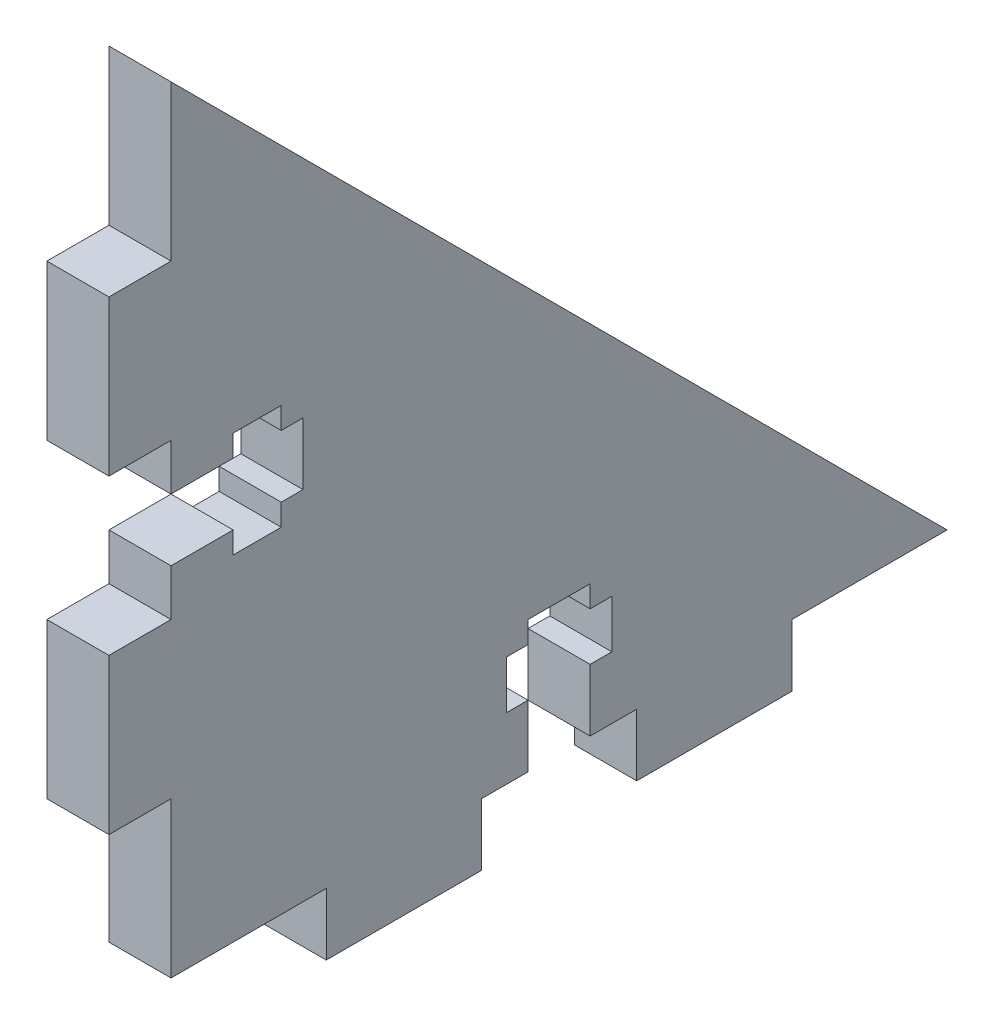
SolidWorks part; units mm, degrees
ref_plane "Front Plane" through (0, 0, 0) normal (0, 0, 1) x (1, 0, 0)
ref_plane "Top Plane" through (0, 0, 0) normal (0, 1, 0) x (1, 0, 0)
ref_plane "Right Plane" through (0, 0, 0) normal (1, 0, 0) x (0, 0, -1)
sketch "Sketch1" plane through (0, 0, 0) normal (1, 0, 0) x (0, 0, -1)
  line L0 (0, 0) -> (0, 23)
  line L1 (0, 50) -> (50, 0)
  line L2 (50, 0) -> (27, 0)
  line L4 (0, 10) -> (-4, 10)
  line L5 (0, 10) -> (0, 20)
  line L6 (0, 20) -> (-4, 20)
  line L7 (-4, 10) -> (-4, 20)
  line L11 (30, 0) -> (40, 0)
  line L12 (10, 0) -> (20, 0)
  line L13 (10, 0) -> (10, -4)
  line L14 (10, -4) -> (20, -4)
  line L15 (20, 0) -> (20, -4)
  line L16 (30, 0) -> (30, -4)
  line L17 (30, -4) -> (40, -4)
  line L18 (40, 0) -> (40, -4)
  line L19 (10, 0) -> (23, 0) construction
  line L20 (0, 30) -> (0, 40)
  line L21 (0, 30) -> (-4, 30)
  line L22 (-4, 30) -> (-4, 40)
  line L23 (0, 40) -> (-4, 40)
  line L24 (0, 10) -> (0, 23) construction
  line L25 (0, 27) -> (0, 30) construction
  line L26 (0, 27) -> (4, 27)
  line L28 (0, 23) -> (4, 23)
  line L29 (8.5, 27) -> (8.5, 23)
  line L30 (27, 0) -> (30, 0) construction
  line L31 (23, 0) -> (0, 0)
  line L32 (4, 28.4) -> (7.1, 28.4)
  line L33 (4, 28.4) -> (4, 27)
  line L34 (4, 21.6) -> (7.1, 21.6)
  line L35 (7.1, 28.4) -> (7.1, 27)
  line L36 (7.1, 23) -> (8.5, 23)
  line L37 (23, 4) -> (21.6, 4)
  line L39 (23, 0) -> (23, 4)
  line L40 (23, 8.5) -> (27, 8.5)
  line L41 (27, 0) -> (27, 4)
  line L44 (28.4, 7.1) -> (27, 7.1)
  line L45 (28.4, 7.1) -> (28.4, 4)
  line L46 (28.4, 4) -> (27, 4)
  line L47 (21.6, 7.1) -> (21.6, 4)
  line L50 (0, 27) -> (0, 50)
  line L51 (4, 23) -> (4, 21.6)
  line L54 (7.1, 27) -> (8.5, 27)
  line L55 (7.1, 23) -> (7.1, 21.6)
  line L57 (23, 7.1) -> (21.6, 7.1)
  line L59 (27, 7.1) -> (27, 8.5)
  line L60 (23, 7.1) -> (23, 8.5)
  point P8 (-4, 15)
  point P17 (15, 0)
  dimension "D1" = 50
  dimension "D2" = 4
  dimension "D3" = 10
  dimension "D4" = 15
  dimension "D6" = 4
  dimension "D7" = 10
  dimension "D8" = 15
  dimension "D10" = 20
  dimension "D11" = 20
  dimension "D12" = 8.5
  dimension "D13" = 3.1
  dimension "D14" = 4
  dimension "D15" = 6.8
  dimension "D16" = 4
  dimension "D17" = 8.5
  dimension "D18" = 4
  dimension "D19" = 3.1
  dimension "D20" = 4
  dimension "D21" = 6.8
  dimension "D22" = 50
  dimension "D9" = 2
  dimension "D5" = 2
extrude "Boss-Extrude1" add sketch "Sketch1" against normal blind 4 contours L57 L60 L40 L59 L44 L45 L46 L41 L2 L1 L50 L20 L26 L33 L32 L35 L54 L29 L36 L55 L34 L51 L28 L0 L31 L12 L39 L37 L47 | L20 L23 L22 L21 | L7 L4 L0 L6 | L15 L12 L13 L14 | L18 L2 L16 L17
